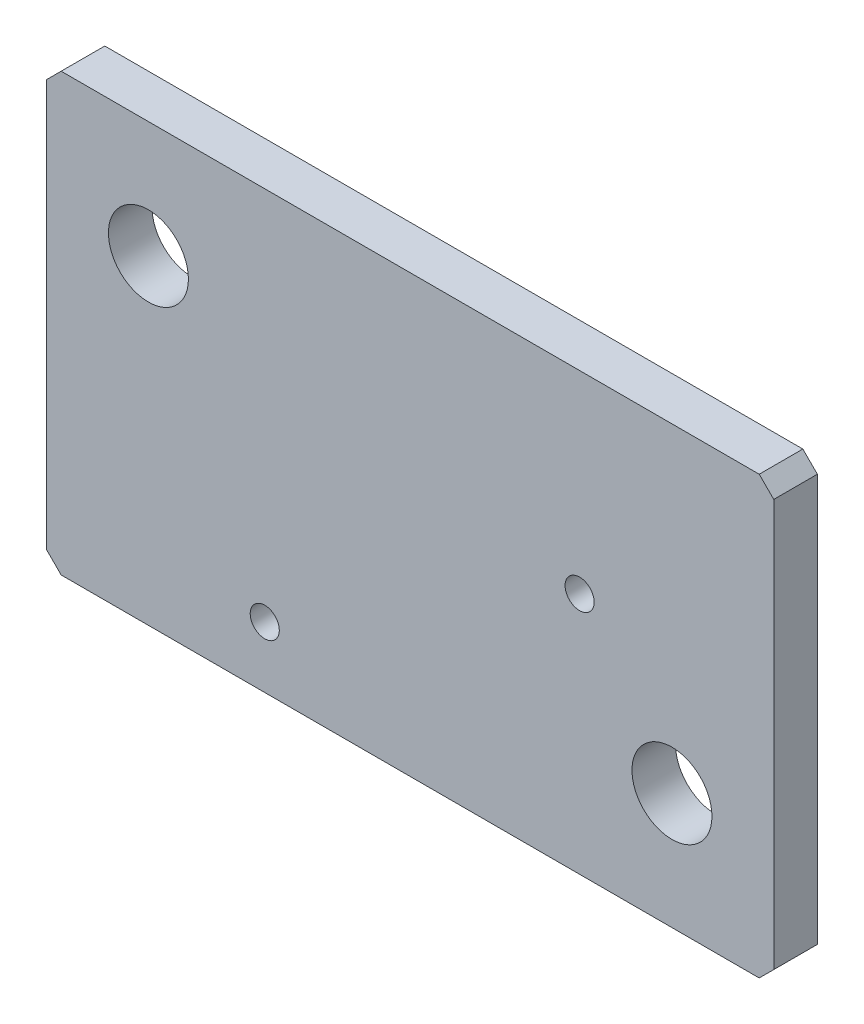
SolidWorks part; units mm, degrees
ref_plane "Face" through (0, 0, 0) normal (0, 0, 1) x (1, 0, 0)
ref_plane "Dessus" through (0, 0, 0) normal (0, 1, 0) x (1, 0, 0)
ref_plane "Droite" through (0, 0, 0) normal (1, 0, 0) x (0, 0, -1)
sketch "Esquisse1" plane through (0, 0, 0) normal (0, 0, 1) x (1, 0, 0)
  line L0 (25, 15) -> (-25, -15) construction
  line L1 (-25, 15) -> (25, 15)
  line L2 (-25, 15) -> (-25, -15)
  line L3 (-25, -15) -> (25, -15)
  line L4 (25, 15) -> (25, -15)
  line L5 (11.6506, 1.7) -> (-10, -10.8) construction
  circle A0 centre (-18, 7) radius 2.75
  circle A1 centre (18, -7) radius 2.75
  circle A2 centre (-10, -10.8) radius 1
  circle A3 centre (11.6506, 1.7) radius 1
  dimension "D6" = 5.5
  dimension "D8" = 2
  dimension "D1" = 50
  dimension "D2" = 30
  dimension "D3" = 18
  dimension "D4" = 18
  dimension "D5" = 8
  dimension "D7" = 8
  dimension "D9" = 15
  dimension "D10" = 4.2
  dimension "D11" = 25
  dimension "D12" = 30
extrude "Extrusion1" add sketch "Esquisse1" along normal blind 3
chamfer "Chanfrein1" distance 1 angle 45 4 edges at (25, 15, 1.5) (25, -15, 1.5) (-25, -15, 1.5) (-25, 15, 1.5)
